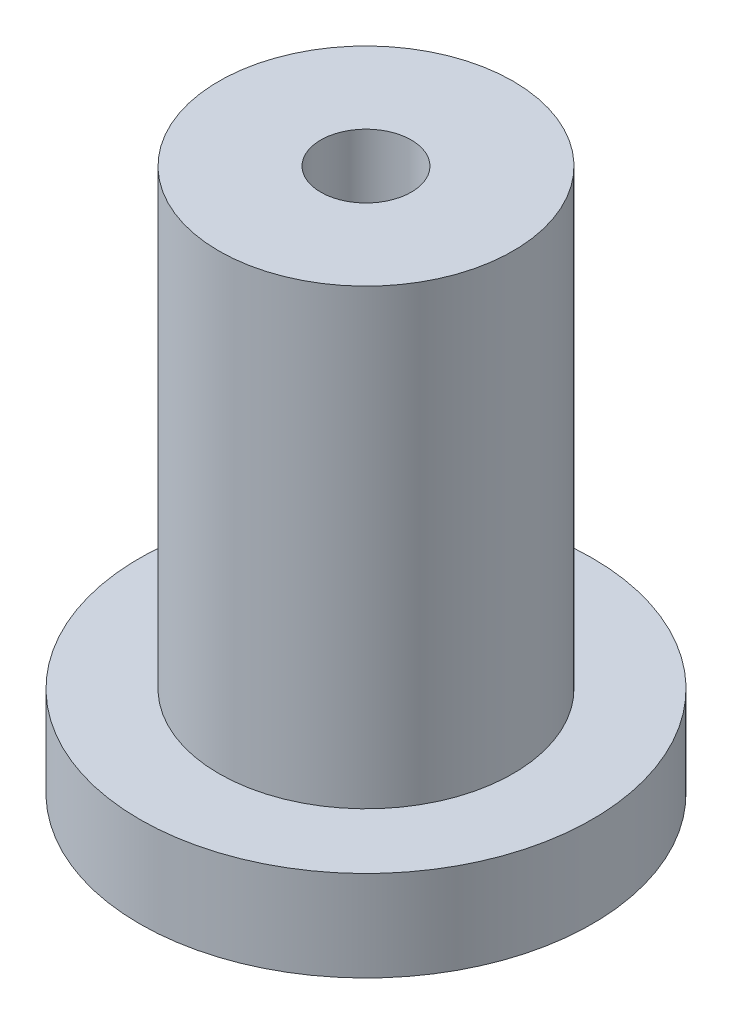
SolidWorks part; units mm, degrees
ref_plane "Front Plane" through (0, 0, 0) normal (0, 0, 1) x (1, 0, 0)
ref_plane "Top Plane" through (0, 0, 0) normal (0, 1, 0) x (1, 0, 0)
ref_plane "Right Plane" through (0, 0, 0) normal (1, 0, 0) x (0, 0, -1)
sketch "草图1" plane through (0, 0, 0) normal (0, 1, 0) x (1, 0, 0)
  circle A0 centre (0, 0) radius 5
extrude "凸台-拉伸1" add sketch "草图1" along normal blind 2
sketch "草图2" plane through (0, 2, 0) normal (0, 1, 0) x (1, 0, 0)
  circle A0 centre (0, 0) radius 3.25
extrude "凸台-拉伸2" add sketch "草图2" along normal blind 10
sketch "草图3" plane through (0, 12, 0) normal (0, 1, 0) x (1, 0, 0)
  circle A0 centre (0, 0) radius 1
extrude "切除-拉伸1" cut sketch "草图3" against normal blind 3
